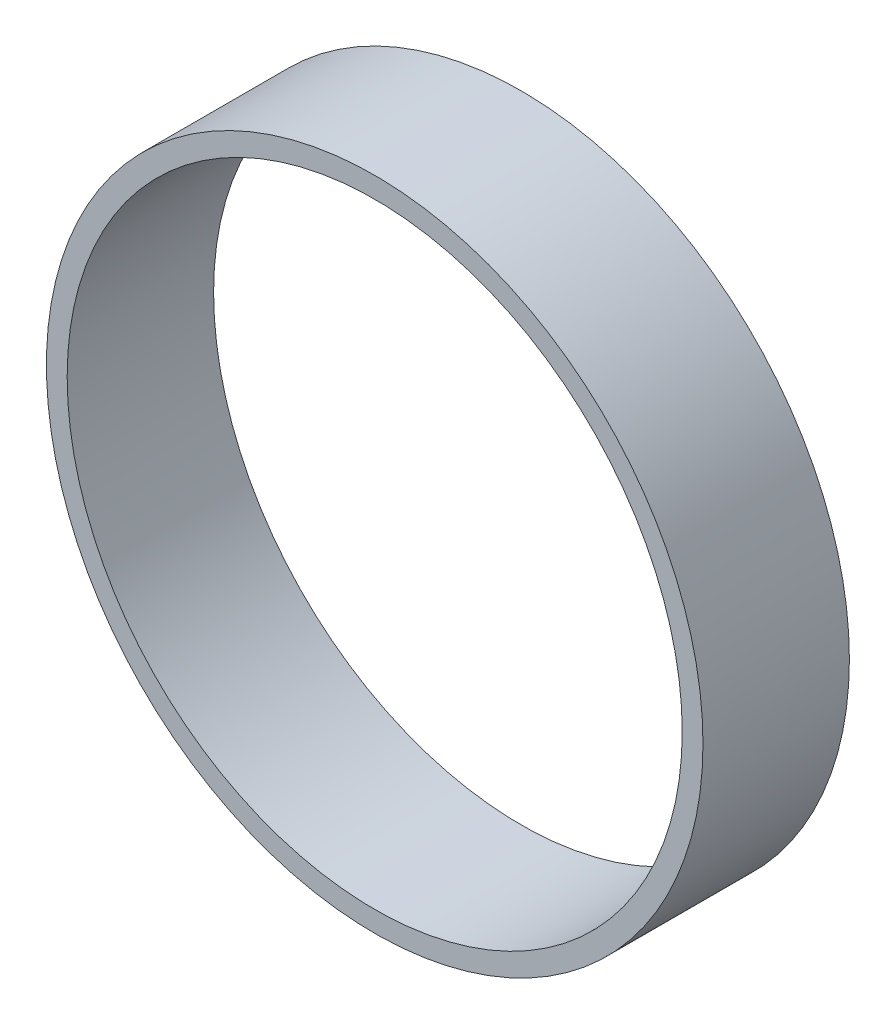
SolidWorks part; units mm, degrees
ref_plane "Front Plane" through (0, 0, 0) normal (0, 0, 1) x (1, 0, 0)
ref_plane "Top Plane" through (0, 0, 0) normal (0, 1, 0) x (1, 0, 0)
ref_plane "Right Plane" through (0, 0, 0) normal (1, 0, 0) x (0, 0, -1)
other "Configuration Table"
sketch "Sketch1" plane through (0, 0, 0) normal (0, 0, 1) x (1, 0, 0)
  circle A0 centre (0, 0) radius 53.35
  circle A1 centre (0, 0) radius 56.95
  dimension "Out_dia" = 113.9
  dimension "Thickness" = 3.6
extrude "BasePipe" add sketch "Sketch1" along normal mid plane 25.4
